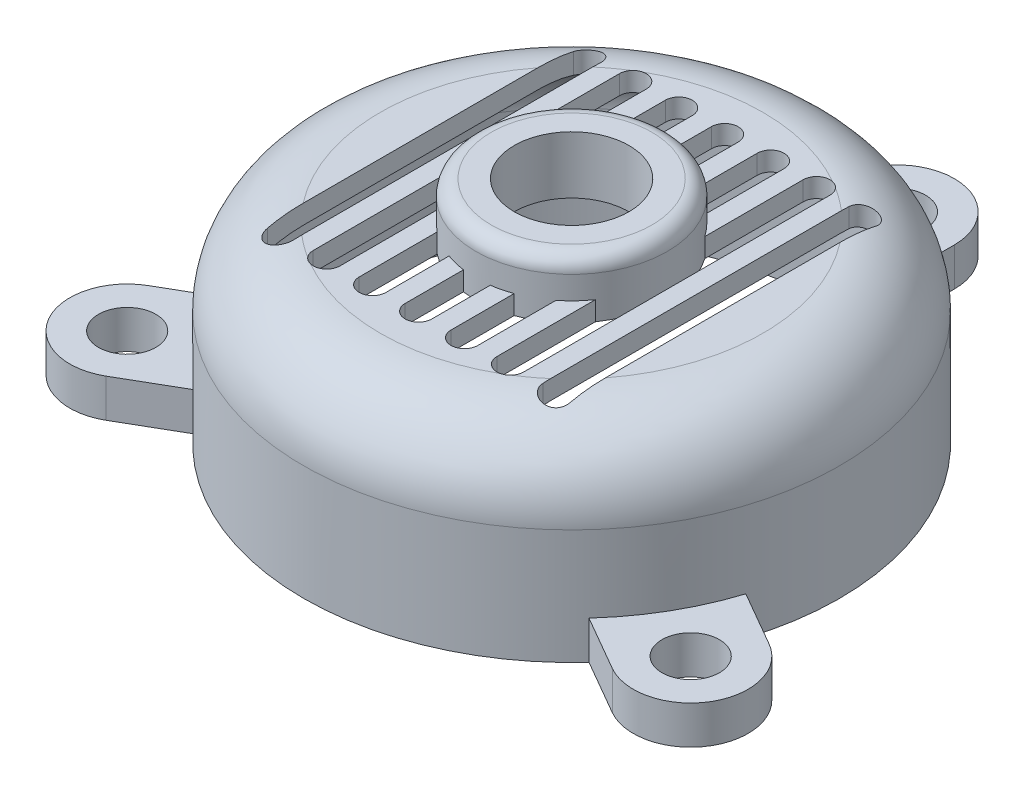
SolidWorks part; units mm, degrees
ref_plane "Front Plane" through (0, 0, 0) normal (0, 0, 1) x (1, 0, 0)
ref_plane "Top Plane" through (0, 0, 0) normal (0, 1, 0) x (1, 0, 0)
ref_plane "Right Plane" through (0, 0, 0) normal (1, 0, 0) x (0, 0, -1)
sketch "Sketch1" plane through (0, 0, 0) normal (0, 0, 1) x (1, 0, 0)
  line L0 (0, 0) -> (0, 84.4826) construction
  line L1 (0, 0) -> (35, 0)
  line L2 (35, 0) -> (35, 15)
  line L3 (25, 25) -> (0, 25)
  line L4 (0, 25) -> (0, 0)
  arc A0 (35, 15) -> (25, 25) centre (25, 15) ccw
  dimension "D3" = 10
  dimension "D1" = 70
  dimension "D2" = 25
revolve "Revolve1" add sketch "Sketch1" angle 360 about L0
shell "Shell1" thickness 2.5
sketch "Sketch3" plane through (0, 0, 0) normal (0, 1, 0) x (1, 0, 0)
  line L0 (0, 35) -> (0, 42.5) construction
  line L1 (7.5, 34.187) -> (7.5, 42.5)
  line L2 (-7.5, 34.187) -> (-7.5, 42.5)
  line L3 (-7.5, 35) -> (-7.5, 42.5) construction
  line L4 (7.5, 35) -> (7.5, 42.5) construction
  circle A0 centre (0, 0) radius 35 construction
  arc A1 (7.5, 34.187) -> (-7.5, 34.187) centre (0, 0) ccw
  circle A2 centre (0, 42.5) radius 3.75
  arc A3 (7.5, 42.5) -> (-7.5, 42.5) centre (0, 42.5) ccw
  dimension "D2" = 7.5
  dimension "D3" = 7.5
  dimension "D1" = 42.5
extrude "Extrude1" add sketch "Sketch3" along normal blind 5
pattern_circular "CirPattern1" count 6 over 360 about axis through (0, 0, 0) along (0, -1, 0) of "Extrude1"
sketch "Sketch5" plane through (0, 25, 0) normal (0, 1, 0) x (1, 0, 0)
  line L0 (18, 20) -> (18, -20) construction
  line L1 (16.25, 20) -> (16.25, -20)
  line L2 (19.75, 20) -> (19.75, -20)
  arc A0 (16.25, 20) -> (19.75, 20) centre (18, 20) cw
  arc A1 (16.25, -20) -> (19.75, -20) centre (18, -20) ccw
  point P2 (18, 0)
  dimension "D3" = 1.75
  dimension "D1" = 40
  dimension "D2" = 18
extrude "Extrude3" cut sketch "Sketch5" against normal through all
pattern_linear "LPattern1" count 7 spacing 6 along (-1, 0, 0) of "Extrude3"
sketch "Sketch4" plane through (0, 22.5, 0) normal (0, 1, 0) x (1, 0, 0)
  circle A0 centre (0, 0) radius 12.5
  dimension "D1" = 25
extrude "Extrude2" add sketch "Sketch4" along normal blind 7.5
fillet "Fillet1" radius 2 1 edges at (0, 30, 12.5)
other "Hole1"
sketch "Sketch6" plane through (0, 30, 0) normal (0, 1, 0) x (-1, 0, 0)
  circle A0 centre (0, 0) radius 7.5
  circle A1 centre (0, 0) radius 10.5 construction
  dimension "D1" = 15
